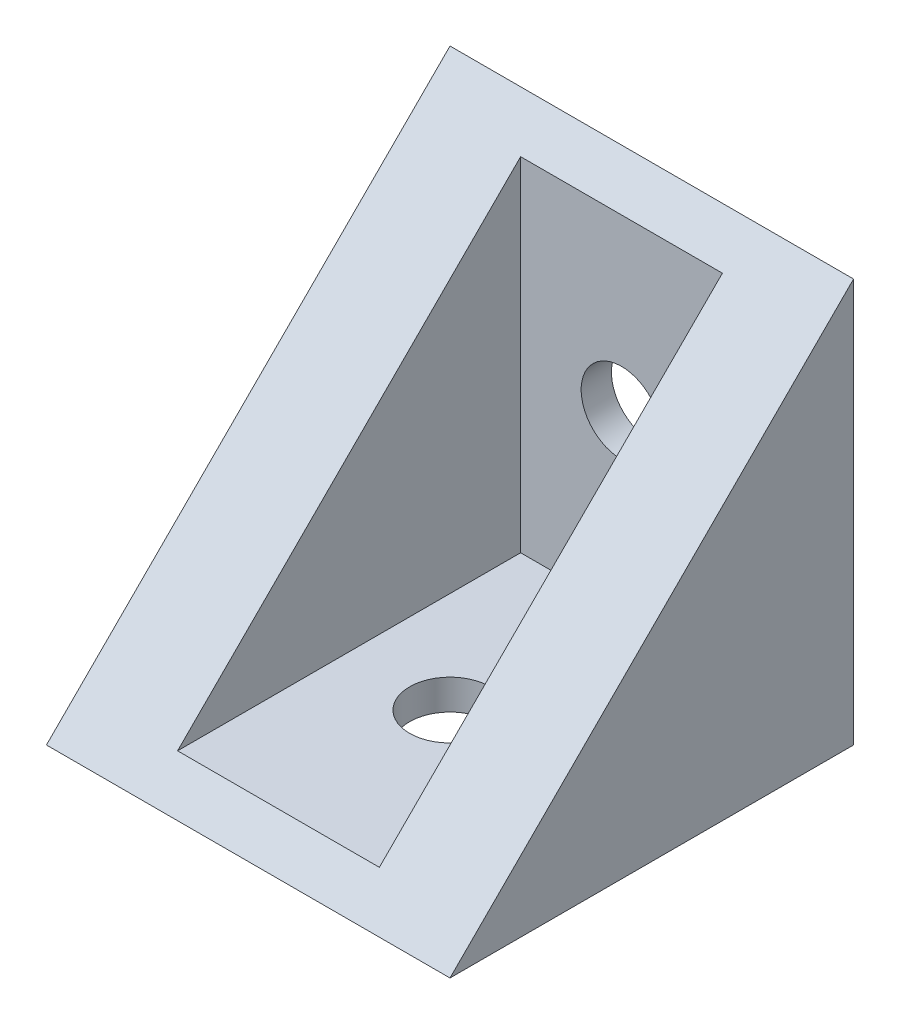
SolidWorks part; units mm, degrees
ref_plane "Alzado" through (0, 0, 0) normal (0, 0, 1) x (1, 0, 0)
ref_plane "Planta" through (0, 0, 0) normal (0, 1, 0) x (1, 0, 0)
ref_plane "Vista lateral" through (0, 0, 0) normal (1, 0, 0) x (0, 0, -1)
sketch "Sketch1" plane through (0, 0, 0) normal (1, 0, 0) x (0, 0, -1)
  line L0 (-20, 0) -> (0, 0)
  line L1 (0, 0) -> (0, 20)
  line L2 (0, 20) -> (-20, 0)
  dimension "D1" = 20
  dimension "D2" = 20
extrude "Boss-Extrude1" add sketch "Sketch1" along normal blind 20
ref_plane "Plane1" through (0, 20, 0) normal (0, 1, 0) x (1, 0, 0)
sketch "Sketch2" plane through (0, 20, 0) normal (0, 1, 0) x (1, 0, 0)
  line L2 (20, -20) -> (0, -20) construction
  line L3 (5, -20) -> (15, -20)
  line L7 (5, -1.5) -> (15, -1.5)
  line L8 (5, -1.5) -> (5, -20)
  line L9 (15, -1.5) -> (15, -20)
  line L10 (20, 0) -> (0, 0) construction
  line L11 (20, 0) -> (20, -20) construction
  dimension "D1" = 10
  dimension "D2" = 1.5
  dimension "D3" = 5
extrude "Cut-Extrude2" cut sketch "Sketch2" against normal blind 18.5
sketch "Sketch4" plane through (0, 1.5, 0) normal (0, 1, 0) x (1, 0, 0)
  line L2 (10, 0.001) -> (10, -20) construction
  line L3 (20, -20) -> (0, -20) construction
  line L4 (10, -20) -> (20, -10) construction
  line L5 (20, 0) -> (20, -20) construction
  line L6 (20, -10) -> (0, -10) construction
  line L7 (0, 0) -> (0, -20) construction
  circle A0 centre (10, -10) radius 2
  dimension "D1" = 4
extrude "Cut-Extrude3" cut sketch "Sketch4" against normal blind 16
sketch "Sketch5" plane through (0, 0, 1.5) normal (0, 0, 1) x (1, 0, 0)
  line L0 (10, 20) -> (10, 0) construction
  line L1 (11, 20) -> (-11, 20) construction
  line L2 (20, 0) -> (0, 0) construction
  line L4 (20, 20) -> (20, 0) construction
  line L5 (20, 10) -> (0, 10) construction
  line L6 (0, 20) -> (0, 0) construction
  circle A0 centre (10, 10) radius 2
  dimension "D1" = 4
extrude "Cut-Extrude4" cut sketch "Sketch5" against normal blind 16
